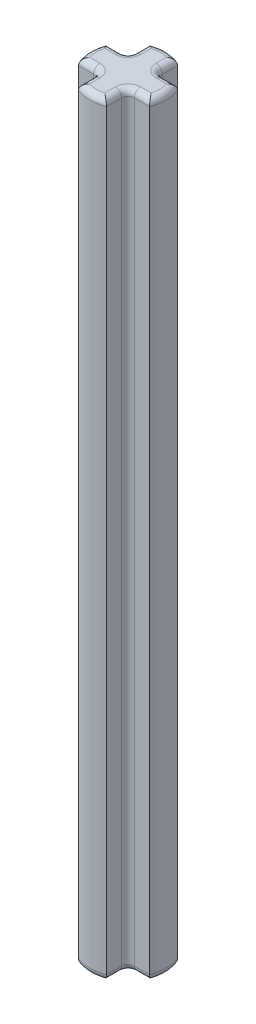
SolidWorks part; units mm, degrees
ref_plane "Front Plane" through (0, 0, 0) normal (0, 0, 1) x (1, 0, 0)
ref_plane "Top Plane" through (0, 0, 0) normal (0, 1, 0) x (1, 0, 0)
ref_plane "Right Plane" through (0, 0, 0) normal (1, 0, 0) x (0, 0, -1)
sketch "Sketch1" plane through (0, 0, 0) normal (0, 1, 0) x (1, 0, 0)
  line L8 (-2.2328, 0.88) -> (-0.88, 0.88)
  line L9 (2.2328, -0.88) -> (0.88, -0.88)
  line L10 (-0.88, 2.2328) -> (-0.88, 0.88)
  line L11 (-0.88, -0.88) -> (-0.88, -2.2328)
  line L12 (0.88, -2.2328) -> (0.88, -0.88)
  line L13 (0.88, 0.88) -> (2.2328, 0.88)
  line L14 (0.88, 0.88) -> (0.88, 2.2328)
  line L15 (-0.88, -0.88) -> (-2.2328, -0.88)
  arc A4 (2.2328, -0.88) -> (2.2328, 0.88) centre (0, 0) ccw
  arc A5 (0.88, 2.2328) -> (-0.88, 2.2328) centre (0, 0) ccw
  arc A6 (-2.2328, 0.88) -> (-2.2328, -0.88) centre (0, 0) ccw
  arc A7 (-0.88, -2.2328) -> (0.88, -2.2328) centre (0, 0) ccw
  dimension "D1" = 0.88
  dimension "D2" = 1.76
  dimension "D3" = 0.88
  dimension "D4" = 1.76
extrude "Boss-Extrude1" add sketch "Sketch1" along normal blind 48
fillet "Fillet7" radius 0.4 28 edges at (-1.5564, 0, -0.88) (-2.4, 0, 0) (-1.5564, 0, 0.88) (-0.88, 0, 1.5564) (0, 0, 2.4) (0.88, 0, 1.5564) (1.5564, 0, 0.88) (2.4, 0, 0) (1.5564, 0, -0.88) (0.88, 0, -1.5564) (0, 0, -2.4) (-0.88, 0, -1.5564) (0, 48, -2.4) (0.88, 48, -1.5564) (1.5564, 48, -0.88) (2.4, 48, 0) (1.5564, 48, 0.88) (0.88, 48, 1.5564) (0, 48, 2.4) (-0.88, 48, 1.5564) (-1.5564, 48, 0.88) (-2.4, 48, 0) (-1.5564, 48, -0.88) (-0.88, 48, -1.5564) (-0.88, 24, -0.88) (0.88, 24, 0.88) (-0.88, 24, 0.88) (0.88, 24, -0.88)
